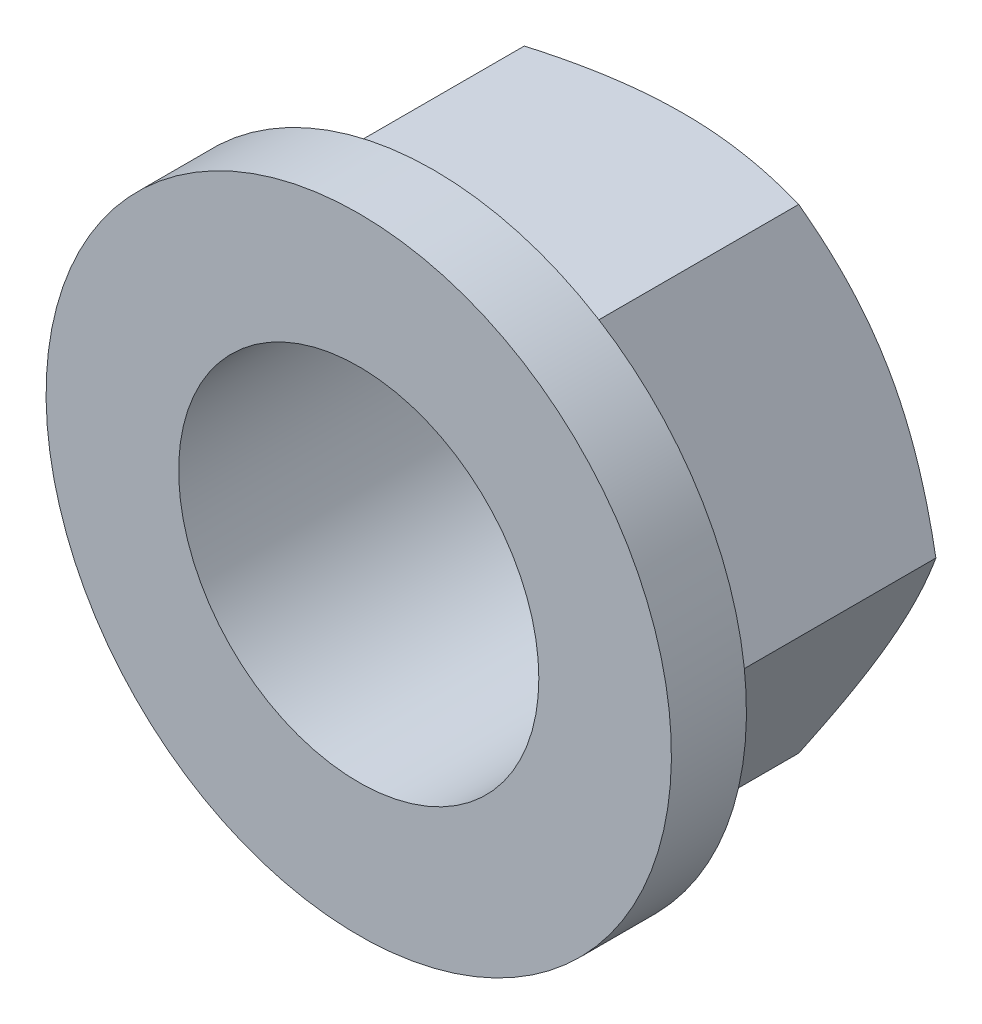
SolidWorks part; units mm, degrees
ref_plane "Plan1" through (0, 0, 0) normal (0, 0, 1) x (1, 0, 0)
ref_plane "Plan2" through (0, 0, 0) normal (0, 1, 0) x (1, 0, 0)
ref_plane "Plan3" through (0, 0, 0) normal (1, 0, 0) x (0, 0, -1)
sketch "Esquisse1" plane through (0, 0, 0) normal (0, 0, 1) x (1, 0, 0)
  line L3 (5.4848, -9.5) -> (10.9697, 0)
  line L4 (10.9697, 0) -> (5.4848, 9.5)
  line L5 (5.4848, 9.5) -> (-5.4848, 9.5)
  line L6 (-5.4848, 9.5) -> (-10.9697, 0)
  line L7 (-10.9697, 0) -> (-5.4848, -9.5)
  line L8 (-5.4848, -9.5) -> (5.4848, -9.5)
  circle A0 centre (0, 0) radius 10.9697 construction
  dimension "D3" = 19
extrude "Base-Extrusion" add sketch "Esquisse1" along normal mid plane 10.8
sketch "Esquisse5" plane through (0, 0, 0) normal (1, 0, 0) x (0, 0, -1)
  line L0 (5.4, -9.5) -> (-5.4, -28.2061)
  line L1 (0, 0) -> (-5.4, 0) construction
  line L2 (-5.4, -9.5) -> (-5.4, 0) construction
  line L3 (-5.4, -28.2061) -> (5.4, -28.2061)
  line L4 (5.4, -28.2061) -> (5.4, -9.5)
  line L5 (0, -18.8531) -> (5.4, -28.2061) construction
sketch "Esquisse4" plane through (0, 0, 5.4) normal (0, 0, 1) x (1, 0, 0)
  circle A0 centre (0, 0) radius 7.2
  dimension "D1" = 14.4
extrude "Enlèv. mat.-Extru.1" cut sketch "Esquisse4" against normal through all
revolve "Enlèvement de matière-Révolution1" cut sketch "Esquisse5" angle 360 about L1
mirror "Symétrie1" about plane through (0, 0, 0) normal (0, 0, 1) of "Enlèvement de matière-Révolution1"
sketch "Esquisse6" plane through (0, 0, 0) normal (1, 0, 0) x (0, 0, -1)
  line L0 (0, 0) -> (-31.0154, 0) construction
  line L1 (-4.5515, 0) -> (-7.5515, 0)
  line L2 (-4.5515, 0) -> (-4.5515, 12.5)
  line L3 (-4.5515, 12.5) -> (-7.5515, 12.5)
  line L4 (-7.5515, 0) -> (-7.5515, 12.5)
  dimension "D1" = 3
  dimension "D2" = 25
revolve "Révolution1" add sketch "Esquisse6" angle 360 about L0
sketch "Esquisse7" plane through (0, 0, 4.5515) normal (0, 0, -1) x (-1, 0, 0)
  circle A1 centre (0, 0) radius 7.2
  circle A2 centre (0, 0) radius 7.2
  dimension "D1" = 0
extrude "Enlèv. mat.-Extru.2" cut sketch "Esquisse7" against normal through all
equation "\"D1@Esquisse4\" = 0.8*\"D2@Représentation de filetage1\""
